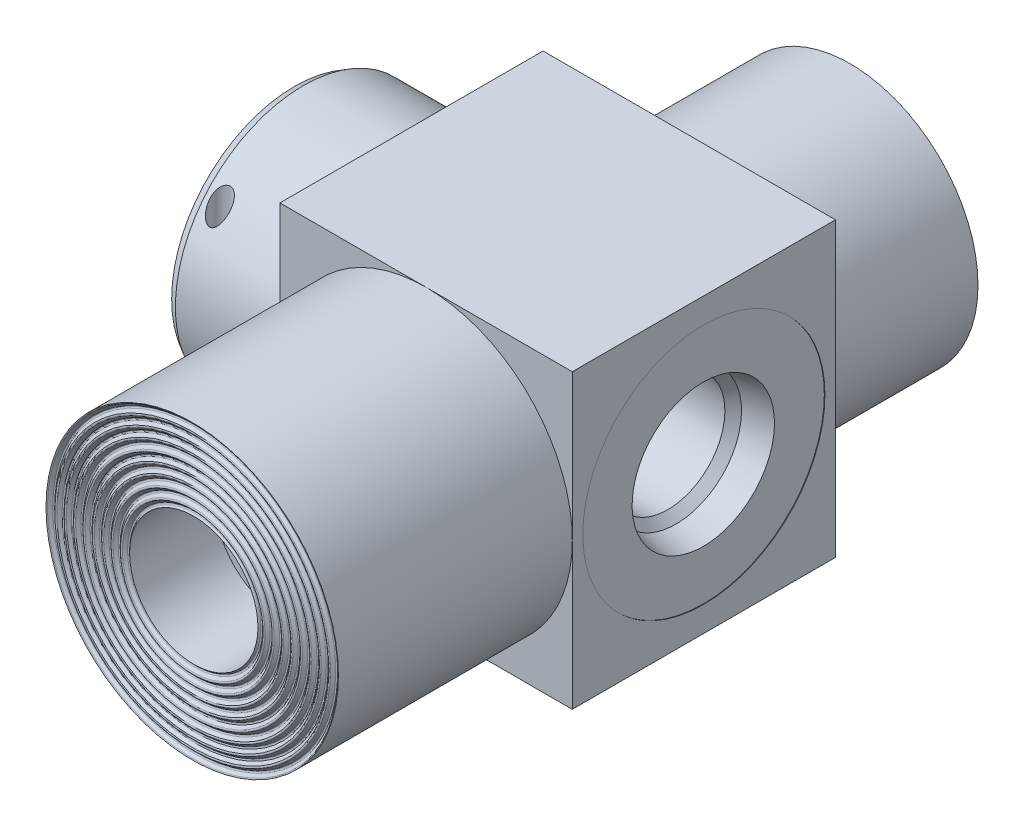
SolidWorks part; units mm, degrees
ref_plane "Plane1" through (0, 0, 0) normal (0, 0, 1) x (1, 0, 0)
ref_plane "Plane2" through (0, 0, 0) normal (0, 1, 0) x (1, 0, 0)
ref_plane "Plane3" through (0, 0, 0) normal (1, 0, 0) x (0, 0, -1)
sketch "Sketch1" plane through (0, 0, 0) normal (0, 0, 1) x (1, 0, 0)
  line L0 (0, 0) -> (0, 12.7) construction
  line L1 (-22.86, 12.7) -> (-22.86, -12.7)
  line L2 (0, 0) -> (-22.86, 0) construction
  line L3 (-22.86, 12.7) -> (12.7, 12.7)
  line L4 (12.7, -12.7) -> (12.7, 12.7)
  line L5 (-22.86, -12.7) -> (12.7, -12.7)
  dimension "D1" = 12.7
  dimension "D2" = 22.86
  dimension "D3" = 12.7
extrude "Base-Extrude" add sketch "Sketch1" along normal blind 57.15
sketch "Sketch2" plane through (0, 0, 0) normal (0, 0, -1) x (-1, 0, 0)
  circle A0 centre (0, 0) radius 11.1125
  dimension "D1" = 22.225
extrude "bladder_base1" cut sketch "Sketch2" against normal blind 13.97 flip side to cut
sketch "Sketch18" plane through (0, 0, 0) normal (0, 0, -1) x (-1, 0, 0)
  circle A0 centre (0, 0) radius 8.0137
  dimension "D1" = 16.0274
extrude "oring_bore1" cut sketch "Sketch18" against normal blind 6.858
sketch "Sketch22" plane through (0, 0, 57.15) normal (0, 0, 1) x (1, 0, 0)
  circle A0 centre (0, 0) radius 12.7
  dimension "D1" = 25.4
extrude "bladder_base2" cut sketch "Sketch22" against normal blind 20.32 flip side to cut
sketch "Sketch23" plane through (-22.86, 0, 0) normal (-1, 0, 0) x (0, 0, 1)
  line L2 (13.97, -12.7) -> (13.97, 12.7) construction
  line L5 (13.97, 0) -> (36.8229, 0) construction
  line L6 (13.97, 0) -> (0, 0) construction
  circle A0 centre (25.4, 0) radius 8.6487
  dimension "D1" = 17.2974
  dimension "D2" = 11.43
extrude "ortman_bore" cut sketch "Sketch23" against normal blind 4.064
sketch "Sketch24" plane through (-22.86, 0, 0) normal (-1, 0, 0) x (0, 0, 1)
  circle A0 centre (25.4, 0) radius 7.9883
  dimension "D1" = 15.9766
extrude "oring_bore" cut sketch "Sketch24" against normal blind 14.732
sketch "Sketch25" plane through (-8.128, 0, 0) normal (-1, 0, 0) x (0, 0, 1)
  circle A0 centre (25.4, 0) radius 3.175
  dimension "D1" = 6.35
extrude "thru" cut sketch "Sketch25" against normal blind 2.54
sketch "Sketch26" plane through (0, 0, 6.858) normal (0, 0, -1) x (-1, 0, 0)
  circle A0 centre (0, 0) radius 6.35
  dimension "D1" = 12.7
extrude "thread_hole1" cut sketch "Sketch26" against normal blind 8.89
sketch "Sketch32" plane through (0, 0, 57.15) normal (0, 0, 1) x (1, 0, 0)
  circle A0 centre (0, 0) radius 5.5753
  dimension "D1" = 11.1506
extrude "bladder_bore2" cut sketch "Sketch32" against normal blind 7.62
sketch "Sketch33" plane through (0, 0, 49.53) normal (0, 0, 1) x (1, 0, 0)
  circle A0 centre (0, 0) radius 3.175
  dimension "D1" = 6.35
extrude "thru_2" cut sketch "Sketch33" against normal blind 2.54
sketch "Sketch34" plane through (0, 0, 46.99) normal (0, 0, 1) x (1, 0, 0)
  circle A0 centre (0, 0) radius 4.826
  dimension "D1" = 9.652
extrude "bladder_thru" cut sketch "Sketch34" against normal blind 50.8
ref_plane "ortman_plane" through (-21.59, 0, 0) normal (-1, 0, 0) x (0, 0, 1)
sketch "Sketch35" plane through (-21.59, 0, 0) normal (-1, 0, 0) x (0, 0, 1)
  circle A0 centre (25.4, 0) radius 9.4488
  dimension "D1" = 18.8976
extrude "ortman_groove" cut sketch "Sketch35" against normal blind 1.651
fillet "Fillet2" radius 0.8128
chamfer "Chamfer1" distance 0.508 angle 60
sketch "Sketch36" plane through (-5.588, 0, 0) normal (-1, 0, 0) x (0, 0, 1)
  circle A0 centre (25.4, 0) radius 4.826
  dimension "D1" = 9.652
extrude "Cut-Extrude15" cut sketch "Sketch36" against normal blind 25.4
sketch "Sketch37" plane through (12.7, 0, 0) normal (1, 0, 0) x (0, 0, -1)
  circle A0 centre (-25.4, 0) radius 9.525 construction
  dimension "D1" = 19.05
sketch "Sketch38" plane through (12.7, 8.4002, 17.612) normal (1, 0, 0) x (0, 0, -1)
  circle A0 centre (-7.788, -8.4002) radius 4.9606
  dimension "D1" = 9.9212
extrude "Cut-Extrude16" cut sketch "Sketch38" against normal blind 12.7
sketch "Sketch39" plane through (12.7, 0, 25.4) normal (1, 0, 0) x (0, 0, -1)
  circle A0 centre (0, 0) radius 10.5156
  dimension "D1" = 21.0312
extrude "Cut-Extrude17" cut sketch "Sketch39" against normal blind 0.0508
sketch "Sketch40" plane through (12.6492, 0, 25.4) normal (1, 0, 0) x (0, 0, -1)
  circle A0 centre (0, 0) radius 6.1849
  dimension "D1" = 12.3698
extrude "Cut-Extrude18" cut sketch "Sketch40" against normal blind 2.3622 draft 12
sketch "Sketch41" plane through (10.287, 0, 25.4) normal (1, 0, 0) x (0, 0, -1)
  circle A0 centre (0, 0) radius 5.6828
  dimension "D1" = 11.3656
extrude "Cut-Extrude19" cut sketch "Sketch41" against normal blind 2.54 draft 45
other "LibFeat2"
chamfer "Chamfer4" distance 1.524 angle 54
sketch "Sketch42" plane through (-22.86, 0, 0) normal (-1, 0, 0) x (0, 0, 1)
  circle A0 centre (25.4, 0) radius 11.1125
  dimension "D1" = 22.225
extrude "Cut-Extrude20" cut sketch "Sketch42" against normal blind 10.16 flip side to cut
chamfer "Chamfer5" distance 0.762 angle 45
chamfer "Chamfer6" distance 0.254 angle 60
sketch "Sketch43" plane through (0, 12.7, 0) normal (0, 1, 0) x (-1, 0, 0)
  line L1 (21.59, -11.43) -> (21.59, 11.43) construction
  line L3 (18.796, 25.4) -> (19.939, 25.4) construction
  circle A0 centre (20.7772, 33.9598) radius 0.889
  dimension "D1" = 1.778
  dimension "D2" = 0.8128
  dimension "D3" = 8.5598
extrude "Cut-Extrude21" cut sketch "Sketch43" against normal blind 12.7
chamfer "Chamfer7" distance 0.762 angle 30
sketch "Sketch44" plane through (0, 0, 0) normal (0, 1, 0) x (1, 0, 0)
  line L0 (0, -57.2209) -> (0, -62.8969) construction
  line L1 (0, 8.9186) -> (0, -6.4072) construction
  line L2 (-2.54, -56.7944) -> (-2.9464, -57.2008)
  line L3 (-5.5753, -57.15) -> (5.5753, -57.15) construction
  line L4 (-2.9464, -57.2008) -> (-3.263, -56.8842)
  line L5 (-3.4426, -56.8842) -> (-3.6694, -57.111)
  line L6 (-3.849, -57.111) -> (-4.0758, -56.8842)
  line L7 (-4.2554, -56.8842) -> (-4.4822, -57.111)
  line L8 (-4.6618, -57.111) -> (-4.8886, -56.8842)
  line L9 (-5.0682, -56.8842) -> (-5.295, -57.111)
  line L10 (-5.4746, -57.111) -> (-5.7014, -56.8842)
  line L11 (-5.881, -56.8842) -> (-6.1078, -57.111)
  line L12 (-6.2874, -57.111) -> (-6.5142, -56.8842)
  line L13 (-6.6938, -56.8842) -> (-6.9206, -57.111)
  line L14 (-7.1002, -57.111) -> (-7.327, -56.8842)
  line L15 (-7.5066, -56.8842) -> (-7.7334, -57.111)
  line L16 (-7.913, -57.111) -> (-8.1398, -56.8842)
  line L17 (-8.3194, -56.8842) -> (-8.5462, -57.111)
  line L18 (-8.7258, -57.111) -> (-8.9526, -56.8842)
  line L19 (-9.1322, -56.8842) -> (-9.359, -57.111)
  line L20 (-9.5386, -57.111) -> (-9.7654, -56.8842)
  line L21 (-9.945, -56.8842) -> (-10.1718, -57.111)
  line L22 (-10.3514, -57.111) -> (-10.5782, -56.8842)
  line L23 (-10.7578, -56.8842) -> (-10.9846, -57.111)
  line L24 (-11.1642, -57.111) -> (-11.391, -56.8842)
  line L25 (-11.5706, -56.8842) -> (-11.7974, -57.111)
  line L26 (-11.977, -57.111) -> (-12.2038, -56.8842)
  line L27 (-12.3834, -56.8842) -> (-12.6102, -57.111)
  line L28 (-12.7898, -57.111) -> (-13.1064, -56.7944)
  line L29 (-13.1064, -56.7944) -> (-13.1064, -58.302)
  line L30 (-2.54, -56.7944) -> (-2.54, -58.302)
  line L31 (-2.54, -58.302) -> (-13.1064, -58.302)
  arc A0 (-3.4426, -56.8842) -> (-3.263, -56.8842) centre (-3.3528, -56.974) cw
  arc A1 (-3.849, -57.111) -> (-3.6694, -57.111) centre (-3.7592, -57.0212) ccw
  arc A2 (-4.2554, -56.8842) -> (-4.0758, -56.8842) centre (-4.1656, -56.974) cw
  arc A3 (-4.6618, -57.111) -> (-4.4822, -57.111) centre (-4.572, -57.0212) ccw
  arc A4 (-5.0682, -56.8842) -> (-4.8886, -56.8842) centre (-4.9784, -56.974) cw
  arc A5 (-5.4746, -57.111) -> (-5.295, -57.111) centre (-5.3848, -57.0212) ccw
  arc A6 (-5.881, -56.8842) -> (-5.7014, -56.8842) centre (-5.7912, -56.974) cw
  arc A7 (-6.2874, -57.111) -> (-6.1078, -57.111) centre (-6.1976, -57.0212) ccw
  arc A8 (-6.6938, -56.8842) -> (-6.5142, -56.8842) centre (-6.604, -56.974) cw
  arc A9 (-7.1002, -57.111) -> (-6.9206, -57.111) centre (-7.0104, -57.0212) ccw
  arc A10 (-7.5066, -56.8842) -> (-7.327, -56.8842) centre (-7.4168, -56.974) cw
  arc A11 (-7.913, -57.111) -> (-7.7334, -57.111) centre (-7.8232, -57.0212) ccw
  arc A12 (-8.3194, -56.8842) -> (-8.1398, -56.8842) centre (-8.2296, -56.974) cw
  arc A13 (-8.7258, -57.111) -> (-8.5462, -57.111) centre (-8.636, -57.0212) ccw
  arc A14 (-9.1322, -56.8842) -> (-8.9526, -56.8842) centre (-9.0424, -56.974) cw
  arc A15 (-9.5386, -57.111) -> (-9.359, -57.111) centre (-9.4488, -57.0212) ccw
  arc A16 (-9.945, -56.8842) -> (-9.7654, -56.8842) centre (-9.8552, -56.974) cw
  arc A17 (-10.3514, -57.111) -> (-10.1718, -57.111) centre (-10.2616, -57.0212) ccw
  arc A18 (-10.7578, -56.8842) -> (-10.5782, -56.8842) centre (-10.668, -56.974) cw
  arc A19 (-11.1642, -57.111) -> (-10.9846, -57.111) centre (-11.0744, -57.0212) ccw
  arc A20 (-11.5706, -56.8842) -> (-11.391, -56.8842) centre (-11.4808, -56.974) cw
  arc A21 (-11.977, -57.111) -> (-11.7974, -57.111) centre (-11.8872, -57.0212) ccw
  arc A22 (-12.3834, -56.8842) -> (-12.2038, -56.8842) centre (-12.2936, -56.974) cw
  arc A23 (-12.7898, -57.111) -> (-12.6102, -57.111) centre (-12.7, -57.0212) ccw
  dimension "D4" = 0.127
  dimension "D1" = 0.4064
  dimension "D2" = 0.4064
  dimension "D3" = 0.3556
revolve "Cut-Revolve1" cut sketch "Sketch44" angle 360 about L0
chamfer "Chamfer8" distance 0.508 angle 60
